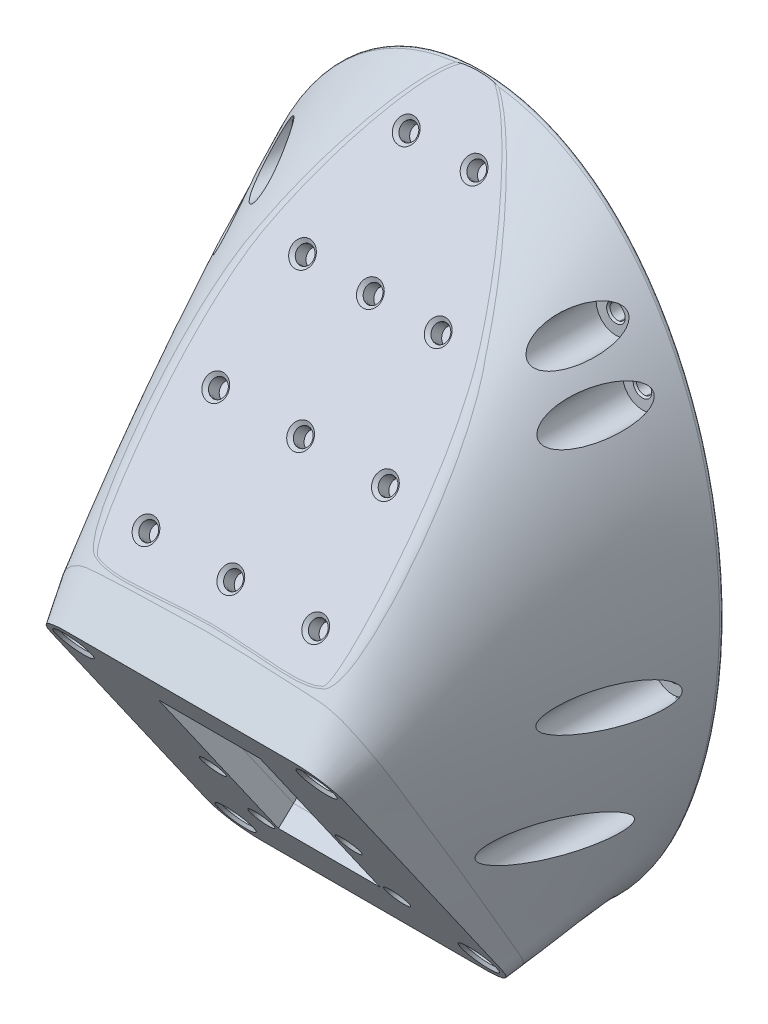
SolidWorks part; units mm, degrees
ref_plane "Front Plane" through (0, 0, 0) normal (0, 0, 1) x (1, 0, 0)
ref_plane "Top Plane" through (0, 0, 0) normal (0, 1, 0) x (1, 0, 0)
ref_plane "Right Plane" through (0, 0, 0) normal (1, 0, 0) x (0, 0, -1)
sketch "Sketch1" plane through (0, 0, 0) normal (0, 0, 1) x (1, 0, 0)
  ellipse E1 centre (0, 0) end of major axis (0, -60) minor radius 40
  ellipse E2 centre (0, 0) end of major axis (0, -60) minor radius 40 construction
  point P0 (0, -63)
  dimension "D1" = 0
  dimension "D2" = 3
ref_plane "Plane1" through (0, -27.5008, 39.2753) normal (0, 0.5736, -0.8192) x (-1, 0, 0)
sketch "Sketch2" plane through (0, -27.5008, 39.2753) normal (0, 0.5736, -0.8192) x (-1, 0, 0)
  line L1 (-20, 25) -> (20, 25) construction
  line L2 (-26, 19) -> (-26, -29)
  line L3 (-20, -35) -> (20, -35)
  line L4 (26, 19) -> (26, -29)
  line L5 (-16, 24.3577) -> (-16, -28.0475) construction
  line L6 (16, -28.0475) -> (16, 24.3577) construction
  arc A0 (-26, 19) -> (-20, 25) centre (-20, 19) cw construction
  arc A1 (20, 25) -> (26, 19) centre (20, 19) cw construction
  arc A2 (20, -35) -> (26, -29) centre (20, -29) ccw
  arc A3 (-20, -35) -> (-26, -29) centre (-20, -29) cw
  arc A4 (20.012, 25) -> (-20.012, 25) centre (0, -9974.98) ccw
  arc A5 (26, 19) -> (20.012, 25) centre (20, 19) ccw
  arc A6 (-26, 19) -> (-20.012, 25) centre (-20, 19) cw
  point P18 (26, -5)
  point P19 (-26, -5)
sketch "Sketch3" plane through (0, 0, 0) normal (1, 0, 0) x (0, 0, -1)
  line L0 (0, -63) -> (-19.2001, -56.1712)
  line L1 (-48.2531, 1.4283) -> (-53.6261, -7.0056)
  line L2 (-53.6147, -7.022) -> (-53.6261, -7.0056) construction
  line L3 (-53.6261, -7.0056) -> (-38.7346, 3.4215) construction
  line L5 (-50.1732, -11.9369) -> (-53.6147, -7.022) construction
  arc A0 (0, 63) -> (-48.2531, 1.4283) centre (290.6752, -214.4929) ccw
  arc A1 (0, -63) -> (-19.2001, -56.1712) centre (-1.9498, -38.0762) cw construction
ref_plane "Plane9" through (-20, -7.022, 53.6147) normal (1, 0.0016, 0.0011) x (0.0011, 0, -1)
sketch "Sketch21" plane through (-20, -7.022, 53.6147) normal (1, 0.0016, 0.0011) x (0.0011, 0, -1)
  line L0 (0, 0) -> (5.373, 8.4339)
  line L1 (0, 0) -> (17.4807, 12.2401) construction
  line L7 (3.4346, -4.9051) -> (0, 0) construction
  arc A0 (5.373, 8.4339) -> (53.6147, 62.8179) centre (199.7382, -115.3906) cw
ref_plane "Plane10" through (20, -7.022, 53.6147) normal (1, -0.0016, -0.0011) x (-0.0011, 0, -1)
sketch "Sketch22" plane through (20, -7.022, 53.6147) normal (1, -0.0016, -0.0011) x (-0.0011, 0, -1)
  line L0 (0, 0) -> (5.373, 8.4339)
  line L3 (0, 0) -> (9.0962, 6.3692) construction
  line L4 (3.4346, -4.9051) -> (0, 0) construction
  arc A0 (5.373, 8.4339) -> (53.6147, 62.8179) centre (199.7382, -115.3906) cw
ref_plane "Plane5" through (0, -23.7554, -16.6337) normal (0, -0.8192, -0.5736) x (-1, 0, 0)
ref_plane "Plane6" through (0, -4.0958, -2.8679) normal (0, -0.8192, -0.5736) x (-1, 0, 0)
ref_plane "Plane7" through (0, 15.5639, 10.898) normal (0, -0.8192, -0.5736) x (-1, 0, 0)
sketch "Sketch13" plane through (0, -23.7554, -16.6337) normal (0, -0.8192, -0.5736) x (-1, 0, 0)
  line L0 (26, -47.9462) -> (28.1838, -41.9462)
  line L1 (26, -47.9462) -> (26, -40.4204) construction
  line L2 (28.1838, -41.9462) -> (35.6133, -20.306)
  line L3 (-26, -47.9462) -> (-28.1838, -41.9462)
  line L4 (-28.1838, -41.9462) -> (28.1838, -41.9462) construction
  line L5 (0, -41.9462) -> (0, 0) construction
  line L6 (-28.1838, -41.9462) -> (-35.6133, -20.306)
sketch "Sketch14" plane through (0, -4.0958, -2.8679) normal (0, -0.8192, -0.5736) x (-1, 0, 0)
  line L0 (26, -47.9462) -> (28.1838, -41.9462)
  line L1 (28.1838, -41.9462) -> (42.7979, -3.501)
  line L2 (0, 0) -> (0, -44.8764) construction
  line L3 (-28.1838, -41.9462) -> (-42.7979, -3.501)
  line L4 (-26, -47.9462) -> (-28.1838, -41.9462)
  line L5 (26, -47.9462) -> (26, -32.5759) construction
sketch "Sketch15" plane through (0, 15.5639, 10.898) normal (0, -0.8192, -0.5736) x (-1, 0, 0)
  line L0 (26, -47.9462) -> (28.1838, -41.9462)
  line L1 (28.1838, -41.9462) -> (40.0007, 13.3039)
  line L2 (26, -47.9462) -> (26, -25.8001) construction
  line L3 (0, 0) -> (0, -32.5143) construction
  line L4 (-26, -47.9462) -> (-28.1838, -41.9462)
  line L5 (-28.1838, -41.9462) -> (-40.0007, 13.3039)
loft "Loft4" add profiles "Sketch1", "Sketch2"
ref_plane "Plane2" through (0, -24.0594, 34.3603) normal (0, -0.5736, 0.8192) x (1, 0, 0)
sketch "Sketch4" plane through (0, 0, 0) normal (0, 0, -1) x (-1, 0, 0)
  point P0 (0, -55)
  point P2 (0, -63)
  dimension "D1" = 0
  dimension "D2" = 8
sketch "Sketch5" plane through (0, -24.0594, 34.3603) normal (0, -0.5736, 0.8192) x (1, 0, 0)
  line L3 (-24, 19) -> (-24, -29)
  line L4 (-24, 19) -> (-24, -29)
  line L5 (-20, -33) -> (20, -33)
  line L6 (-20, -33) -> (20, -33)
  line L7 (24, -29) -> (24, 19)
  line L8 (24, -29) -> (24, 19)
  arc A5 (24, 19) -> (20.008, 23) centre (20, 19) ccw
  arc A6 (24, 19) -> (20.008, 23) centre (20, 19) ccw
  arc A7 (20.008, 23) -> (-20.008, 23) centre (0, -9974.98) ccw
  arc A8 (20.008, 23) -> (-20.008, 23) centre (0, -9974.98) ccw
  arc A9 (-20.008, 23) -> (-24, 19) centre (-20, 19) ccw
  arc A10 (-20.008, 23) -> (-24, 19) centre (-20, 19) ccw
  arc A11 (-24, -29) -> (-20, -33) centre (-20, -29) ccw
  arc A20 (-24, -29) -> (-20, -33) centre (-20, -29) ccw
  arc A21 (20, -33) -> (24, -29) centre (20, -29) ccw
  arc A22 (20, -33) -> (24, -29) centre (20, -29) ccw
  dimension "D1" = 2
loft "Cut-Loft1" cut profiles "Sketch4", "Sketch5"
sketch "Sketch7" plane through (0, -24.0594, 34.3603) normal (0, 0.5736, -0.8192) x (-1, 0, 0)
  line L4 (0, 0) -> (0, -21.4075) construction
  line L5 (-9, 15.5925) -> (9, 15.5925)
  line L6 (-9, 15.5925) -> (-9, -21.4075)
  line L7 (-9, -21.4075) -> (9, -21.4075)
  line L8 (9, 15.5925) -> (9, -21.4075)
  dimension "D1" = 18
  dimension "D2" = 27
  dimension "D3" = 10
extrude "Cut-Extrude1" cut sketch "Sketch7" against normal through all
chamfer "Chamfer1" distance 2 distance2 6 4 edges at (0, -41.5954, 22.0815) (-9, -26.4411, 32.6927) (9, -26.4411, 32.6927) (0, -11.2868, 43.3038)
sketch "Sketch11" plane through (0, -27.5008, 39.2753) normal (0, -0.5736, 0.8192) x (1, 0, 0)
  circle A0 centre (-12, -6.4075) radius 1.5
  circle A1 centre (-12, -21.4075) radius 1.5
  circle A2 centre (12, -21.4075) radius 1.5
  circle A3 centre (12, -6.4075) radius 1.5
  dimension "D1" = 3
extrude "Cut-Extrude5" cut sketch "Sketch11" against normal blind 3
chamfer "Chamfer2" distance 0.6 angle 45 4 edges at (12, -33.9783, 34.7397) (12, -46.2656, 26.136) (-12, -46.2656, 26.136) (-12, -33.9783, 34.7397)
fillet "Fillet1" radius 3 8 edges
fillet "Fillet3" radius 0.5 1 edges at (0, -63, 0)
sketch "Sketch16" plane through (0, 0, 0) normal (0, 0, -1) x (-1, 0, 0)
  circle A0 centre (-26.8799, 40) radius 4.5
  circle A1 centre (-31.5786, 30.9201) radius 4.5
  circle A2 centre (-36.9233, -10.0082) radius 4.5
  circle A3 centre (-31.955, -30) radius 4.5
  circle A4 centre (31.955, -30) radius 4.5
  circle A5 centre (36.9232, -10.0086) radius 4.5
  circle A6 centre (31.5783, 30.9198) radius 4.5
  circle A7 centre (26.8809, 40) radius 4.5
  dimension "D1" = 9
extrude "Boss-Extrude1" add sketch "Sketch16" against normal up to surface (1.9145 mm away)
fillet "Fillet7" radius 0.5 24 edges at (-27.4267, 29.1837, 3.6375) (-23.2616, 37.3259, 3.1922) (23.0058, 37.7106, 3.1881) (27.5215, 28.9734, 3.6359) (32.4318, -9.7326, 6.9049) (27.5176, -29.2519, 15.6007) (-27.5267, -29.1999, 15.6069) (-32.4518, -9.5021, 6.8864)
ref_plane "Plane8" through (0, 0, 3.2) normal (0, 0, -1) x (-1, 0, 0)
sketch "Sketch17" plane through (0, 0, 3.2) normal (0, 0, -1) x (-1, 0, 0)
  circle A0 centre (-26.8799, 40) radius 3.5
  circle A1 centre (-31.5786, 30.9201) radius 3.5
  circle A2 centre (26.8809, 40) radius 3.5
  circle A3 centre (31.5783, 30.9198) radius 3.5
  circle A4 centre (36.9232, -10.0086) radius 3.5
  circle A5 centre (31.955, -30) radius 3.5
  circle A6 centre (-31.955, -30) radius 3.5
  circle A7 centre (-36.9233, -10.0082) radius 3.5
  dimension "D1" = 7
extrude "Cut-Extrude6" cut sketch "Sketch17" against normal through all
sketch "Sketch18" plane through (0, 0, 0) normal (0, 0, -1) x (-1, 0, 0)
  circle A0 centre (-26.8799, 40) radius 1.35
  circle A1 centre (-31.5786, 30.9201) radius 1.35
  circle A2 centre (26.8809, 40) radius 1.35
  circle A3 centre (31.5783, 30.9198) radius 1.35
  circle A4 centre (-36.9233, -10.0082) radius 1.35
  circle A5 centre (-31.955, -30) radius 1.35
  circle A6 centre (31.955, -30) radius 1.35
  circle A7 centre (36.9232, -10.0086) radius 1.35
  dimension "D1" = 2.7
extrude "Cut-Extrude7" cut sketch "Sketch18" against normal through all
fillet "Fillet4" [suppressed] radius 1
sketch "Sketch19" plane through (0, 0, 0) normal (0, 1, 0) x (1, 0, 0)
  line L0 (0, 0) -> (0, -11) construction
  line L1 (5, -11) -> (5, 1)
  line L2 (5, 1) -> (-5, 1)
  line L3 (-5, 1) -> (-5, -11)
  arc A0 (-5, -11) -> (5, -11) centre (0, -11) ccw
  dimension "D2" = 10
  dimension "D1" = 11
  dimension "D3" = 1
extrude "Cut-Extrude8" cut sketch "Sketch19" against normal through all
fillet "Fillet5" radius 2 2 edges at (-5, -58.3519, 0) (5, -58.3519, 0)
sketch "Sketch20" plane through (0, -27.5008, 39.2753) normal (0, -0.5736, 0.8192) x (1, 0, 0)
  line L0 (0, -5) -> (0, 0) construction
  line L1 (21.5, -30) -> (-21.5, -30) construction
  line L2 (21.5, -30) -> (21.5, 20) construction
  line L3 (21.5, 20) -> (-21.5, 20) construction
  line L4 (-21.5, -30) -> (-21.5, 20) construction
  line L5 (21.5, -30) -> (-21.5, 20) construction
  line L6 (21.5, 20) -> (-21.5, -30) construction
  line L10 (20, 25) -> (-20, 25) construction
  line L11 (26, 19) -> (26, -29) construction
  line L12 (20, -35) -> (-20, -35) construction
  circle A0 centre (-21.5, 20) radius 2.35
  circle A1 centre (21.5, 20) radius 2.35
  circle A2 centre (21.5, -30) radius 2.35
  circle A3 centre (-21.5, -30) radius 2.35
  point P0 (0, -5)
  dimension "D1" = 4.7
  dimension "D2" = 5
  dimension "D3" = 4.5
  dimension "D4" = 5
extrude "Cut-Extrude9" cut sketch "Sketch20" against normal blind 4
chamfer "Chamfer3" distance 0.3 distance2 3.8 4 edges at (21.5, -13.0428, 49.3989) (-21.5, -13.0428, 49.3989) (-21.5, -54.0004, 20.7201) (21.5, -54.0004, 20.7201)
chamfer "Chamfer4" distance 0.5 angle 45 4 edges at (21.5, -13.2885, 49.2268) (21.5, -54.2461, 20.548) (-21.5, -54.2461, 20.548) (-21.5, -13.2885, 49.2268)
ref_plane "Plane11" through (0, 23.9707, 30.5869) normal (0, 0.6168, 0.7871) x (1, 0, 0)
sketch "Sketch23" plane through (0, 23.9707, 30.5869) normal (0, 0.6168, 0.7871) x (1, 0, 0)
  circle A0 centre (0, 0) radius 75
  dimension "D1" = 150
extrude "Cut-Extrude10" cut sketch "Sketch23" along normal blind 10
fillet "Fillet6" radius 3 1 edges at (17.0229, 1.056, 48.5449)
sketch "Sketch24" plane through (0, 23.9707, 30.5869) normal (0, 0.6168, 0.7871) x (1, 0, 0)
  line L0 (0, 7.5868) -> (0, 27.5868) construction
  line L9 (-6, 37.5868) -> (6, 37.5868) construction
  line L10 (-6, 37.5868) -> (-6, 17.5868) construction
  line L11 (-6, 17.5868) -> (6, 17.5868) construction
  line L12 (6, 37.5868) -> (6, 17.5868) construction
  line L13 (-6, 37.5868) -> (6, 17.5868) construction
  line L14 (-6, 17.5868) -> (6, 37.5868) construction
  line L15 (-12, -2.4132) -> (12, -2.4132) construction
  line L16 (-12, -2.4132) -> (-12, 17.5868) construction
  line L17 (-12, 17.5868) -> (12, 17.5868) construction
  line L18 (12, -2.4132) -> (12, 17.5868) construction
  line L19 (-12, -2.4132) -> (12, 17.5868) construction
  line L20 (-12, 17.5868) -> (12, -2.4132) construction
  line L21 (0, -28.6401) -> (0, 49.5868) construction
  line L23 (15, -22.4132) -> (-15, -22.4132) construction
  line L24 (15, -22.4132) -> (15, -2.4132) construction
  line L25 (15, -2.4132) -> (-15, -2.4132) construction
  line L26 (-15, -22.4132) -> (-15, -2.4132) construction
  line L27 (15, -22.4132) -> (-15, -2.4132) construction
  line L28 (15, -2.4132) -> (-15, -22.4132) construction
  circle A0 centre (-6, 37.5868) radius 1.5
  circle A1 centre (6, 37.5868) radius 1.5
  circle A2 centre (12, 17.5868) radius 1.5
  circle A3 centre (-12, 17.5868) radius 1.5
  circle A4 centre (-15, -2.4132) radius 1.5
  circle A5 centre (15, -2.4132) radius 1.5
  circle A6 centre (-15, -22.4132) radius 1.5
  circle A7 centre (15, -22.4132) radius 1.5
  circle A8 centre (0, -22.4132) radius 1.5
  circle A9 centre (0, -2.4132) radius 1.5
  circle A10 centre (0, 17.5868) radius 1.5
  point P0 (0, 27.5868)
  point P5 (0, 7.5868)
  point P19 (0, -12.4132)
  dimension "D10" = 3
  dimension "D2" = 20
  dimension "D3" = 12
  dimension "D4" = 20
  dimension "D5" = 24
  dimension "D6" = 12
  dimension "D8" = 30
  dimension "D9" = 20
extrude "Cut-Extrude11" cut sketch "Sketch24" against normal blind 3
chamfer "Chamfer5" distance 0.6 angle 45 11 edges at (6, 52.3743, 8.3273) (-6, 52.3743, 8.3273) (-12, 36.6324, 20.664) (0, 36.6324, 20.664) (12, 36.6324, 20.664) (15, 20.8906, 33.0007) (0, 20.8906, 33.0007) (-15, 20.8906, 33.0007) (15, 5.1488, 45.3374) (0, 5.1488, 45.3374) (-15, 5.1488, 45.3374)
chamfer "Chamfer6" distance 0.3 angle 45 16 edges at (25.5299, 40, 3.2) (25.5299, 40, 0) (30.2286, 30.9201, 3.2) (30.2286, 30.9201, 0) (35.5733, -10.0082, 3.2) (35.5733, -10.0082, 0) (30.605, -30, 3.2) (30.605, -30, 0) (-33.305, -30, 3.2) (-33.305, -30, 0) (-38.2732, -10.0086, 3.2) (-38.2732, -10.0086, 0) (-32.9283, 30.9198, 3.2) (-32.9283, 30.9198, 0) (-28.2309, 40, 3.2) (-28.2309, 40, 0)
fillet "Fillet8" radius 3 4 edges at (0, -9.6485, 44.451) (11, -26.4411, 32.6927) (0, -43.2337, 20.9343) (-11, -26.4411, 32.6927)
equation "\"D3@Sketch2\"=\"D2@Sketch2\""
equation "\"D2@Sketch15\"=\"D2@Sketch13\""
equation "\"D2@Sketch14\"=\"D2@Sketch13\""
equation "\"D2@Sketch21\"=\"D1@Sketch3\""
equation "\"D2@Sketch22\"=\"D1@Sketch3\""
equation "\"D1@Sketch21\"=\"D3@Sketch3\""
equation "\"D1@Sketch22\"=\"D3@Sketch3\""
